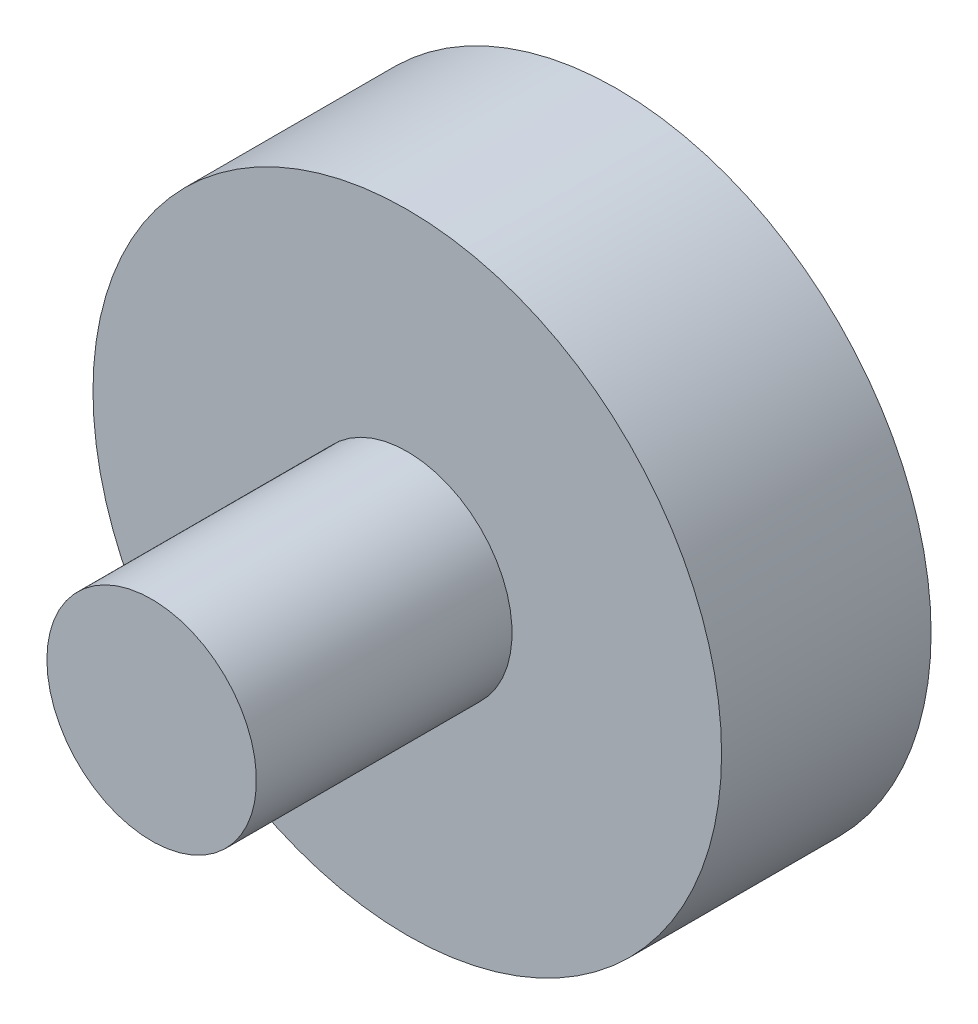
SolidWorks part; units mm, degrees
ref_plane "Front Plane" through (0, 0, 0) normal (0, 0, 1) x (1, 0, 0)
ref_plane "Top Plane" through (0, 0, 0) normal (0, 1, 0) x (1, 0, 0)
ref_plane "Right Plane" through (0, 0, 0) normal (1, 0, 0) x (0, 0, -1)
sketch "Sketch1" plane through (0, 0, 0) normal (0, 0, 1) x (1, 0, 0)
  circle A0 centre (0, 0) radius 75
  dimension "D1" = 150
extrude "Boss-Extrude1" add sketch "Sketch1" along normal blind 50
sketch "Sketch2" plane through (0, 0, 50) normal (0, 0, 1) x (1, 0, 0)
  circle A0 centre (0, 0) radius 25
extrude "Boss-Extrude2" add sketch "Sketch2" along normal blind 61
